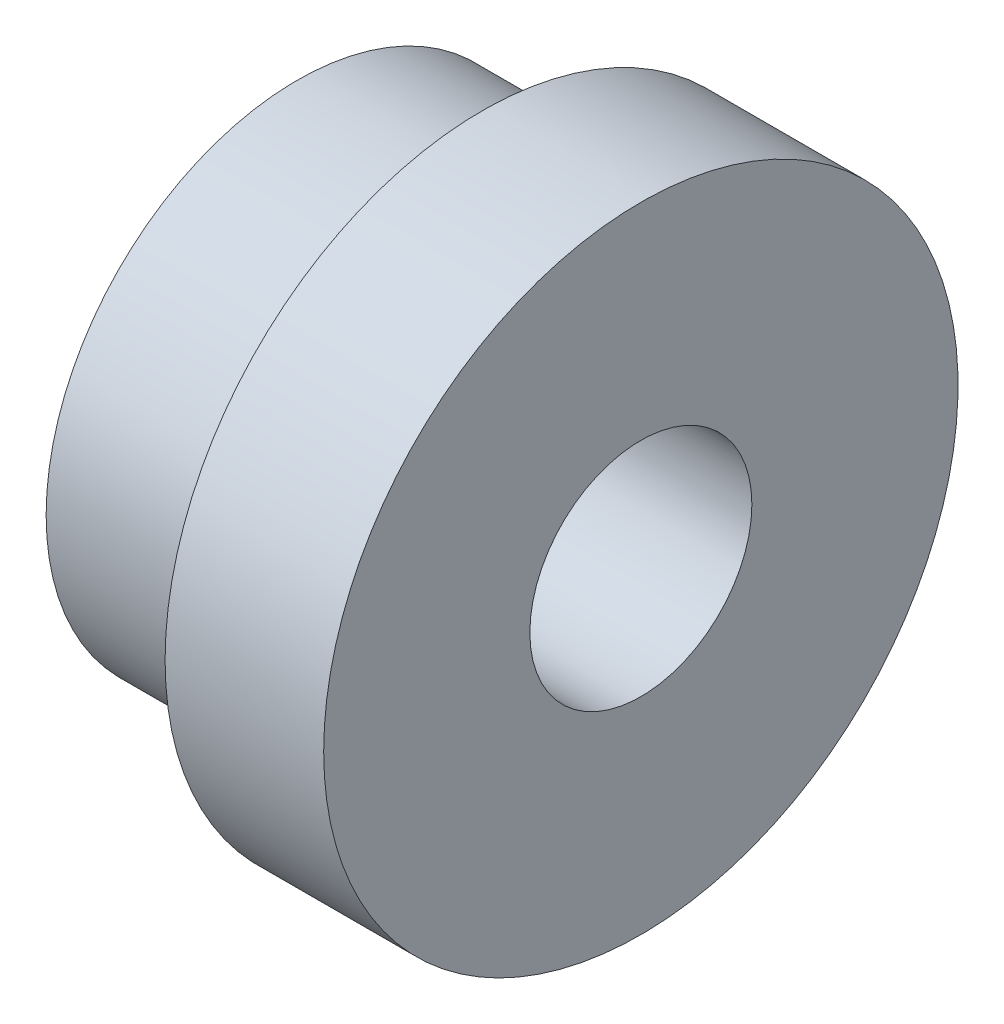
SolidWorks part; units mm, degrees
ref_plane "Front" through (0, 0, 0) normal (0, 0, 1) x (1, 0, 0)
ref_plane "Top" through (0, 0, 0) normal (0, 1, 0) x (1, 0, 0)
ref_plane "Right" through (0, 0, 0) normal (1, 0, 0) x (0, 0, -1)
sketch "Sketch1" plane through (0, 0, 0) normal (0, 1, 0) x (1, 0, 0)
  line L0 (0, 0) -> (6.5, 0)
  line L1 (6.5, 0) -> (6.5, 6)
  line L2 (6.5, 6) -> (3.5, 6)
  line L3 (3.5, 6) -> (3.5, 4.75)
  line L4 (3.5, 4.75) -> (0, 4.75)
  line L5 (0, 4.75) -> (0, 0)
revolve "Revolve1" add sketch "Sketch1" angle 360 about L0
sketch "Sketch2" plane through (6.5, 0, 0) normal (1, 0, 0) x (0, 0, -1)
  point P0 (0, 0)
hole_wizard "M5 Tapped Hole1" positions "3DSketch1" profile "Sketch4" tap size "M5" standard "ISO"
sketch3d "3DSketch1"
  point P0 (6.5, 0, 0)
sketch "Sketch4" plane through (6.5, 0, 0) normal (0, 1, 0) x (0, 0, -1)
  line L0 (0, 0) -> (0, 6.5)
  line L1 (0, 6.5) -> (2.1, 6.5)
  line L2 (2.1, 6.5) -> (2.1, 0)
  line L5 (2.1, 0) -> (0, 0)
  line L11 (0, -6.35) -> (0, 107.95) construction
  dimension "Thru Tap Drill Dia." = 4.2
  dimension "Thru Tap Drill Depth" = 6.5
